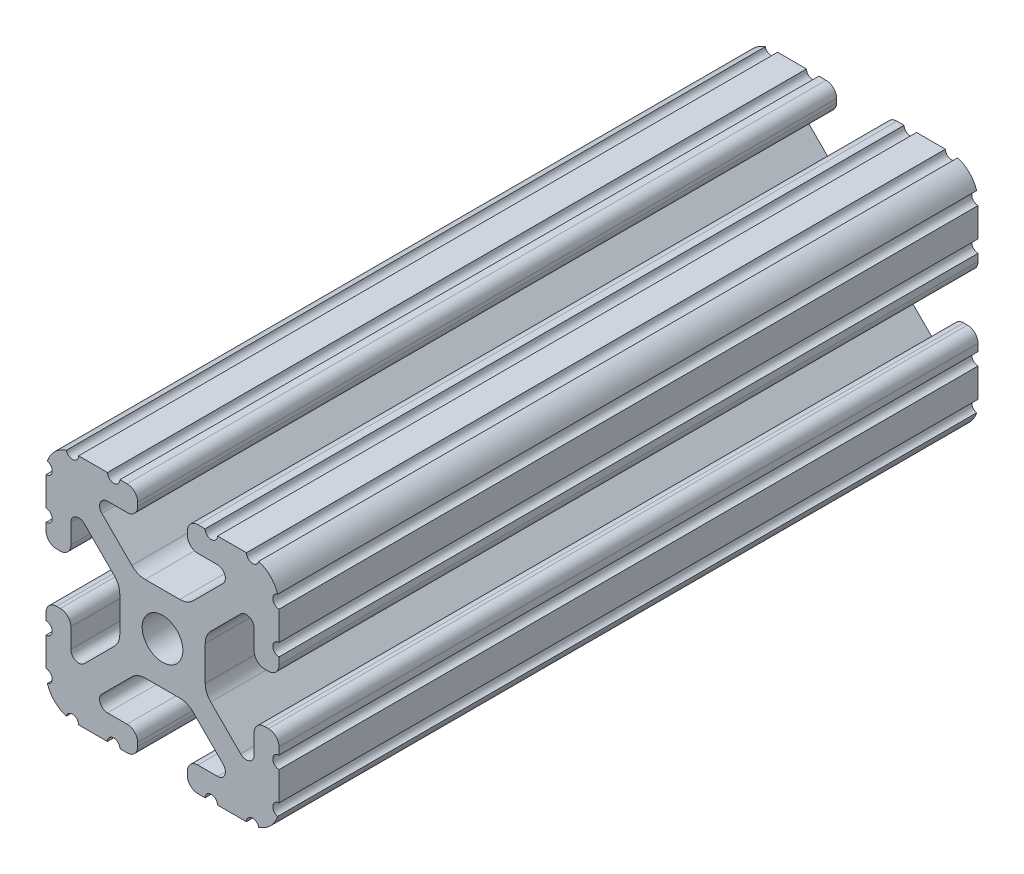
SolidWorks part; units mm, degrees
ref_plane "Front Plane" through (0, 0, 0) normal (0, 0, 1) x (1, 0, 0)
ref_plane "Top Plane" through (0, 0, 0) normal (0, 1, 0) x (1, 0, 0)
ref_plane "Right Plane" through (0, 0, 0) normal (1, 0, 0) x (0, 0, -1)
sketch "Sketch2" plane through (0, 0, 0) normal (0, 0, 1) x (1, 0, 0)
  line L0 (0, 19.05) -> (0, -19.05) construction
  line L1 (-19.05, 0) -> (19.05, 0) construction
  line L2 (4.064, -19.05) -> (19.05, -19.05)
  line L3 (19.05, -19.05) -> (19.05, -4.064)
  line L4 (4.064, -19.05) -> (4.064, -14.986)
  line L5 (4.064, -14.986) -> (12.1123, -14.986)
  line L6 (12.1123, -14.986) -> (4.1113, -6.985)
  line L7 (0, 0) -> (19.05, -19.05) construction
  line L8 (19.05, -4.064) -> (14.986, -4.064)
  line L9 (14.986, -4.064) -> (14.986, -12.1123)
  line L10 (14.986, -12.1123) -> (6.985, -4.1113)
  circle A0 centre (0, 0) radius 3.3274
  arc A1 (8.9963, -14.986) -> (9.909, -12.7826) centre (8.9963, -13.6953) ccw construction
  point P8 (0, -6.985)
sketch "Sketch3" plane through (0, 0, 0) normal (1, 0, 0) x (0, 0, -1)
  line L0 (-457.2, -19.05) -> (457.2, -19.05) construction
  line L1 (-431.8, 0) -> (431.8, 0) construction
sketch "Sketch4" plane through (0, 0, 0) normal (0, 0, 1) x (1, 0, 0)
  line L0 (5.7912, -19.05) -> (14.3002, -19.05)
  line L1 (4.064, -19.05) -> (19.05, -19.05) construction
  line L2 (4.064, -19.05) -> (4.064, -14.986) construction
  line L3 (4.064, -14.986) -> (12.1123, -14.986) construction
  line L4 (4.064, -16.7132) -> (4.064, -17.3228)
  line L5 (5.7912, -14.986) -> (8.9963, -14.986)
  line L6 (0, -6.985) -> (2.833, -6.985)
  line L7 (12.1123, -14.986) -> (4.1113, -6.985) construction
  line L8 (5.0152, -7.8889) -> (9.909, -12.7826)
  line L9 (19.05, -19.05) -> (19.05, -4.064) construction
  line L10 (14.986, -12.1123) -> (6.985, -4.1113) construction
  line L11 (14.986, -4.064) -> (14.986, -12.1123) construction
  line L12 (14.986, -8.9963) -> (14.986, -5.7912)
  line L13 (19.05, -4.064) -> (14.986, -4.064) construction
  line L14 (16.7132, -4.064) -> (17.3228, -4.064)
  line L15 (19.05, -5.7912) -> (19.05, -14.3002)
  line L16 (12.7826, -9.909) -> (7.8889, -5.0152)
  line L17 (6.985, 0) -> (6.985, -2.833)
  line L18 (-19.05, 0) -> (19.05, 0) construction
  line L19 (0, -6.985) -> (0, -3.3274)
  line L20 (0, 19.05) -> (0, -19.05) construction
  line L21 (6.985, 0) -> (3.3274, 0)
  arc A0 (4.064, -17.3228) -> (5.7912, -19.05) centre (5.7912, -17.3228) ccw
  arc A2 (4.064, -16.7132) -> (5.7912, -14.986) centre (5.7912, -16.7132) cw
  arc A3 (8.9963, -14.986) -> (9.909, -12.7826) centre (8.9963, -13.6953) ccw
  arc A4 (2.833, -6.985) -> (5.0152, -7.8889) centre (2.833, -10.0711) cw
  arc A5 (14.3002, -19.05) -> (19.05, -14.3002) centre (14.3002, -14.3002) ccw
  arc A6 (12.7826, -9.909) -> (14.986, -8.9963) centre (13.6953, -8.9963) ccw
  arc A7 (14.986, -5.7912) -> (16.7132, -4.064) centre (16.7132, -5.7912) cw
  arc A8 (17.3228, -4.064) -> (19.05, -5.7912) centre (17.3228, -5.7912) cw
  arc A9 (7.8889, -5.0152) -> (6.985, -2.833) centre (10.0711, -2.833) cw
  circle A10 centre (0, 0) radius 3.3274 construction
  arc A11 (0, -3.3274) -> (3.3274, 0) centre (0, 0) ccw
extrude "Boss-Extrude1" add sketch "Sketch4" along normal mid plane 914.4
sketch "Sketch5" plane through (0, 0, 0) normal (0, 0, 1) x (1, 0, 0)
  line L0 (4.064, -19.05) -> (19.05, -19.05) construction
  line L1 (5.7912, -14.986) -> (8.9963, -14.986) construction
  line L3 (0, 0) -> (19.05, -19.05) construction
  line L4 (8.9963, -14.986) -> (8.9963, -19.05) construction
  line L5 (12.1123, -14.986) -> (4.1113, -6.985) construction
  circle A0 centre (14.7395, -19.05) radius 1.016
  circle A1 centre (7.9803, -19.05) radius 1.016
  circle A2 centre (19.05, -14.7395) radius 1.016
  circle A3 centre (19.05, -7.9803) radius 1.016
  point P10 (7.3938, -14.986)
  point P12 (13.6953, -8.9963)
extrude "Cut-Extrude1" cut sketch "Sketch5" against normal through all both and the other way through all
mirror "Mirror1" about plane through (0, 0, 0) normal (1, 0, 0)
mirror "Mirror2" about plane through (0, 0, 0) normal (0, 1, 0)
sketch "Sketch6" plane through (0, 0, 457.2) normal (0, 0, 1) x (1, 0, 0)
  line L1 (19.5673, -19.4887) -> (-19.5673, -19.4887)
  line L2 (19.5673, -19.4887) -> (19.5673, 19.4887)
  line L3 (19.5673, 19.4887) -> (-19.5673, 19.4887)
  line L4 (-19.5673, -19.4887) -> (-19.5673, 19.4887)
  line L5 (19.5673, -19.4887) -> (-19.5673, 19.4887) construction
  line L6 (19.5673, 19.4887) -> (-19.5673, -19.4887) construction
  point P0 (0, 0)
extrude "Cut-Extrude2" cut sketch "Sketch6" against normal offset from surface (800.1 mm away) 114.3
equation "\"D1@Boss-Extrude1\"=\"Length@Sketch3\""
equation "\"D1@Sketch2\"=\"Thickness@Sketch2\""
equation "\"D2@Sketch4\"=\"Slot Inner Width@Sketch2\"*0.15"
equation "\"D1@Sketch4\"=\"D3@Sketch4\"*2.75"
equation "\"D3@Sketch4\"=\"Thickness@Sketch2\"*0.425"
equation "\"D1@Sketch5\"=\"Thickness@Sketch2\"*0.5"
